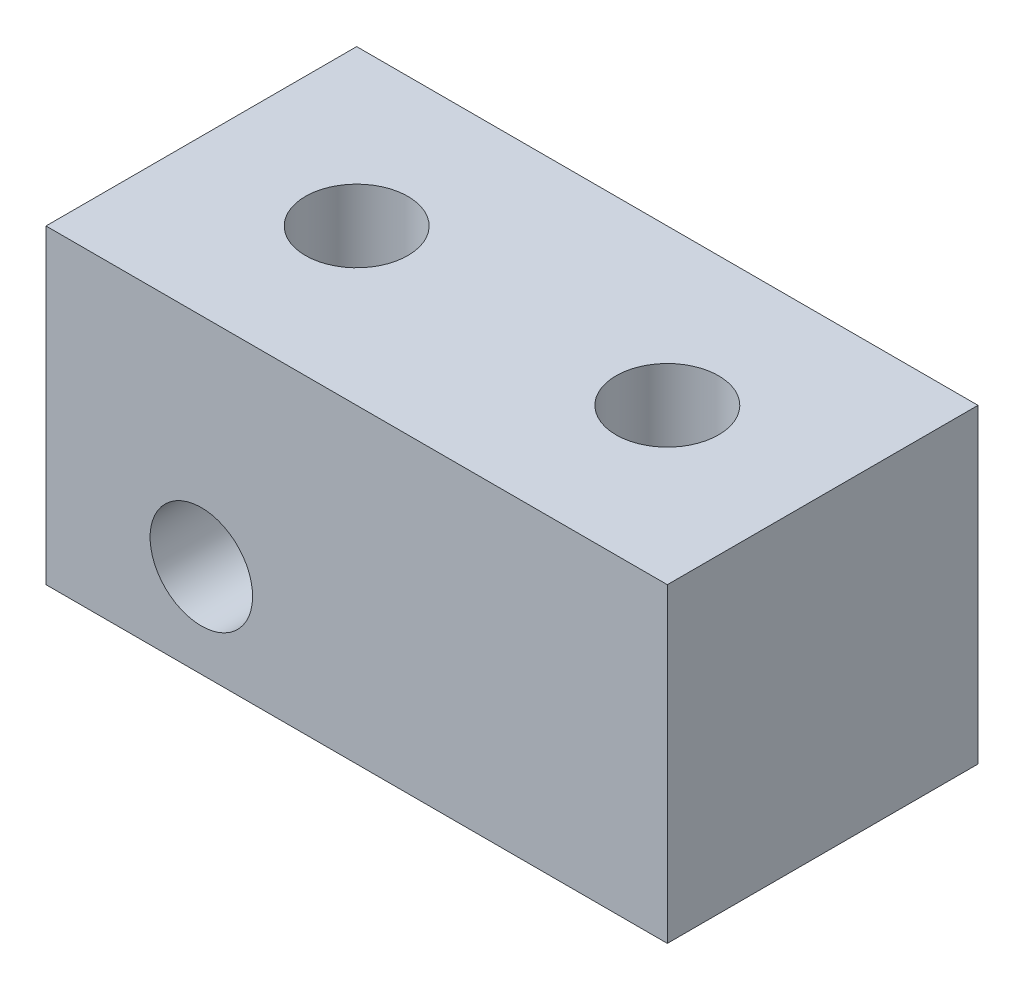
SolidWorks part; units mm, degrees
ref_plane "Front Plane" through (0, 0, 0) normal (0, 0, 1) x (1, 0, 0)
ref_plane "Top Plane" through (0, 0, 0) normal (0, 1, 0) x (1, 0, 0)
ref_plane "Right Plane" through (0, 0, 0) normal (1, 0, 0) x (0, 0, -1)
sketch "Sketch1" plane through (0, 0, 0) normal (0, 0, 1) x (1, 0, 0)
  line L1 (0, 0) -> (20, 0)
  line L2 (0, 0) -> (0, 10)
  line L3 (0, 10) -> (20, 10)
  line L4 (20, 0) -> (20, 10)
  dimension "D1" = 10
  dimension "D2" = 20
extrude "Boss-Extrude1" add sketch "Sketch1" along normal blind 10
sketch "Sketch2" plane through (0, 10, 0) normal (0, 1, 0) x (1, 0, 0)
  line L0 (0, -5) -> (20, -5) construction
  line L1 (0, -10) -> (0, 0) construction
  line L2 (20, -10) -> (20, 0) construction
  point P6 (5, -5)
  point P7 (15, -5)
  dimension "D1" = 5
  dimension "D2" = 5
hole_wizard "M4 Tapped Hole1" positions "3DSketch1" profile "Sketch3" tap size "M4" standard "DIN"
sketch3d "3DSketch1"
  point P0 (5, 10, 5)
  point P3 (15, 10, 5)
sketch "Sketch3" plane through (5, 10, 5) normal (1, 0, 0) x (0, 0, 1)
  line L0 (0, 0) -> (0, 10)
  line L1 (0, 10) -> (1.65, 10)
  line L2 (1.65, 10) -> (1.65, 0)
  line L5 (1.65, 0) -> (0, 0)
  line L11 (0, -6.35) -> (0, 107.95) construction
  dimension "Thru Tap Drill Dia." = 3.3
  dimension "Thru Tap Drill Depth" = 10
sketch "Sketch4" plane through (0, 0, 10) normal (0, 0, 1) x (1, 0, 0)
  line L0 (5, 0) -> (5, 10) construction
  line L1 (0, 0) -> (20, 0) construction
  line L2 (20, 10) -> (0, 10) construction
  line L3 (0, 10) -> (0, 0) construction
  point P8 (5, 3)
  dimension "D1" = 5
  dimension "D2" = 3
hole_wizard "Ø3.3 (3.3) Diameter Hole1" positions "3DSketch2" profile "Sketch5" hole size "Ø3.3" standard "ISO"
sketch3d "3DSketch2"
  point P0 (5, 3, 10)
sketch "Sketch5" plane through (5, 3, 10) normal (1, 0, 0) x (0, -1, 0)
  line L0 (0, 0) -> (0, 10)
  line L1 (0, 10) -> (1.65, 10)
  line L2 (1.65, 10) -> (1.65, 0)
  line L5 (1.65, 0) -> (0, 0)
  line L11 (0, -6.35) -> (0, 107.95) construction
  dimension "Thru Hole Dia." = 3.3
  dimension "Thru Hole Depth" = 10
